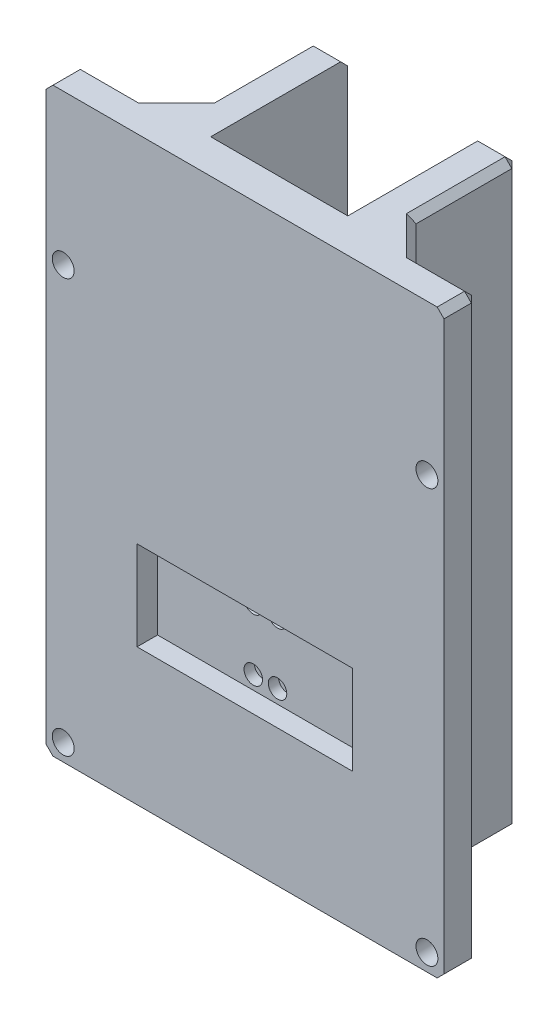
SolidWorks part; units mm, degrees
ref_plane "Alzado" through (0, 0, 0) normal (0, 0, 1) x (1, 0, 0)
ref_plane "Planta" through (0, 0, 0) normal (0, 1, 0) x (1, 0, 0)
ref_plane "Vista lateral" through (0, 0, 0) normal (1, 0, 0) x (0, 0, -1)
sketch "Croquis1" plane through (0, 0, 1000.05) normal (0, 0, -1) x (-1, 0, 0)
  line L5 (-24.9816, 15.1619) -> (30.8042, 15.1619) construction
  line L6 (-26.3958, 15.1619) -> (31.8042, 15.1619)
  line L7 (-26.3958, 15.1619) -> (-26.3958, -69.8381)
  line L8 (-26.3958, -69.8381) -> (31.8042, -69.8381)
  line L9 (31.8042, 15.1619) -> (31.8042, -69.8381)
  line L10 (30.8042, -69.8381) -> (-25.3958, -69.8381) construction
  line L11 (31.8042, -68.8381) -> (31.8042, 10.1619) construction
  line L12 (-26.3958, -68.8381) -> (-26.3958, 10.1619) construction
  circle A0 centre (-23.8958, -6.8381) radius 1.6
  circle A1 centre (29.3042, -6.8381) radius 1.6
  circle A2 centre (-23.8958, -67.3381) radius 1.6
  circle A3 centre (29.3042, -67.3381) radius 1.6
  dimension "D1" = 3.2
  dimension "D2" = 3.2
  dimension "D3" = 3.2
  dimension "D4" = 3.2
extrude "Saliente-Extruir1" add sketch "Croquis1" along normal blind 5
ref_plane "Plano1" through (-31.8042, 15.1619, 1000.05) normal (0, 1, 0) x (1, 0, 0)
sketch "Croquis2" plane through (-31.8042, 15.1619, 1000.05) normal (0, 1, 0) x (1, 0, 0)
  line L0 (0, 5) -> (58.2, 5) construction
  line L2 (19.075, 25) -> (19.075, 5)
  line L4 (39.125, 25) -> (39.125, 5)
  line L5 (19.075, 25) -> (39.125, 5) construction
  line L6 (19.075, 5) -> (39.125, 25) construction
  line L7 (14.075, 5) -> (19.075, 5)
  line L8 (19.075, 25) -> (14.075, 25)
  line L9 (14.075, 25) -> (14.075, 5)
  line L10 (39.125, 25) -> (44.125, 25)
  line L11 (44.125, 25) -> (44.125, 5)
  line L12 (39.125, 5) -> (44.125, 5)
  point P0 (29.1, 15)
  dimension "D1" = 20.05
  dimension "D2" = 20
  dimension "D3" = 5
  dimension "D4" = 5
extrude "Saliente-Extruir2" add sketch "Croquis2" against normal blind 85
sketch "Croquis3" plane through (12.3208, 0, 0) normal (1, 0, 0) x (0, 0, -1)
  line L0 (-995.05, 15.1619) -> (-975.05, 15.1619) construction
  line L1 (-975.05, -69.8381) -> (-975.05, 15.1619) construction
  line L2 (-985.05, -27.3381) -> (-985.05, -6.0881) construction
  line L3 (-985.05, -27.3381) -> (-985.05, -47.9631) construction
  circle A0 centre (-985.05, -27.3381) radius 2.1
  circle A1 centre (-985.05, -6.0881) radius 2.1
  circle A2 centre (-985.05, -47.9631) radius 2.1
  dimension "D1" = 4.2
  dimension "D2" = 42.5
  dimension "D3" = 10
  dimension "D5" = 21.25
  dimension "D7" = 20.625
  dimension "D4" = 2
  dimension "D6" = 2
extrude "Cortar-Extruir1" cut sketch "Croquis3" against normal through all
chamfer "Chaflán2" distance 5 angle 45 2 edges at (12.3208, -27.3381, 995.05) (-17.7292, -27.3381, 995.05)
chamfer "Chaflán3" distance 1 angle 45 24 edges at (9.8208, 15.1619, 975.05) (9.8208, -69.8381, 975.05) (12.3208, 15.1619, 982.55) (12.3208, -69.8381, 982.55) (14.8208, 15.1619, 992.55) (21.8583, 15.1619, 995.05) (26.3958, 15.1619, 997.55) (26.3958, -69.8381, 997.55) (26.3958, -27.3381, 995.05) (21.8583, -69.8381, 995.05) (14.8208, -69.8381, 992.55) (12.3208, -27.3381, 975.05) (-15.2292, 15.1619, 975.05) (-15.2292, -69.8381, 975.05) (-31.8042, 15.1619, 997.55) (-31.8042, -69.8381, 997.55) (-27.2667, -69.8381, 995.05) (-31.8042, -27.3381, 995.05) (-27.2667, 15.1619, 995.05) (-20.2292, -69.8381, 992.55) (-17.7292, -69.8381, 982.55) (-17.7292, 15.1619, 982.55) (-17.7292, -27.3381, 975.05) (-20.2292, 15.1619, 992.55)
sketch "Croquis4" plane through (0, 0, 1000.05) normal (0, 0, 1) x (1, 0, 0)
  line L1 (-18.5042, -36.7881) -> (13.0458, -36.7881)
  line L2 (-18.5042, -36.7881) -> (-18.5042, -49.8381)
  line L3 (-18.5042, -49.8381) -> (13.0458, -49.8381)
  line L4 (13.0458, -36.7881) -> (13.0458, -49.8381)
  line L5 (-18.5042, -36.7881) -> (13.0458, -49.8381) construction
  line L6 (-18.5042, -49.8381) -> (13.0458, -36.7881) construction
  line L7 (-12.7292, -69.8381) -> (-12.7292, 15.1619) construction
  line L8 (-30.8042, -69.8381) -> (25.3958, -69.8381) construction
  point P0 (-2.7292, -43.3131)
  dimension "D1" = 31.55
  dimension "D2" = 13.05
  dimension "D3" = 10
  dimension "D4" = 20
extrude "Cortar-Extruir2" cut sketch "Croquis4" against normal blind 3
sketch "Croquis5" plane through (0, 0, 997.05) normal (0, 0, 1) x (1, 0, 0)
  line L0 (-0.9542, -47.8381) -> (-0.9542, -38.8381) construction
  line L1 (-2.3042, -47.8381) -> (-2.3042, -38.8381) construction
  line L2 (0.3958, -47.8381) -> (0.3958, -38.8381) construction
  line L3 (13.0458, -49.8381) -> (13.0458, -36.7881) construction
  line L4 (-18.5042, -49.8381) -> (13.0458, -49.8381) construction
  line L5 (-4.5042, -47.8381) -> (-4.5042, -38.8381) construction
  line L6 (-5.8542, -47.8381) -> (-5.8542, -38.8381) construction
  line L7 (-3.1542, -47.8381) -> (-3.1542, -38.8381) construction
  line L8 (-18.5042, -36.7881) -> (-18.5042, -49.8381) construction
  arc A2 (-2.3042, -47.8381) -> (0.3958, -47.8381) centre (-0.9542, -47.8381) ccw construction
  arc A3 (0.3958, -38.8381) -> (-2.3042, -38.8381) centre (-0.9542, -38.8381) ccw construction
  arc A4 (-5.8542, -47.8381) -> (-3.1542, -47.8381) centre (-4.5042, -47.8381) ccw construction
  arc A5 (-3.1542, -38.8381) -> (-5.8542, -38.8381) centre (-4.5042, -38.8381) ccw construction
  circle A6 centre (-4.5042, -38.8381) radius 1.35
  circle A7 centre (-0.9542, -38.8381) radius 1.35
  circle A8 centre (-4.5042, -47.8381) radius 1.35
  circle A9 centre (-0.9542, -47.8381) radius 1.35
  point P2 (-0.9542, -43.3381)
  point P13 (-4.5042, -43.3381)
  dimension "D2" = 1.35
  dimension "D5" = 1.35
  dimension "D1" = 9
  dimension "D3" = 14
  dimension "D4" = 6.5
  dimension "D6" = 14
extrude "Cortar-Extruir3" cut sketch "Croquis5" against normal blind 1.5
